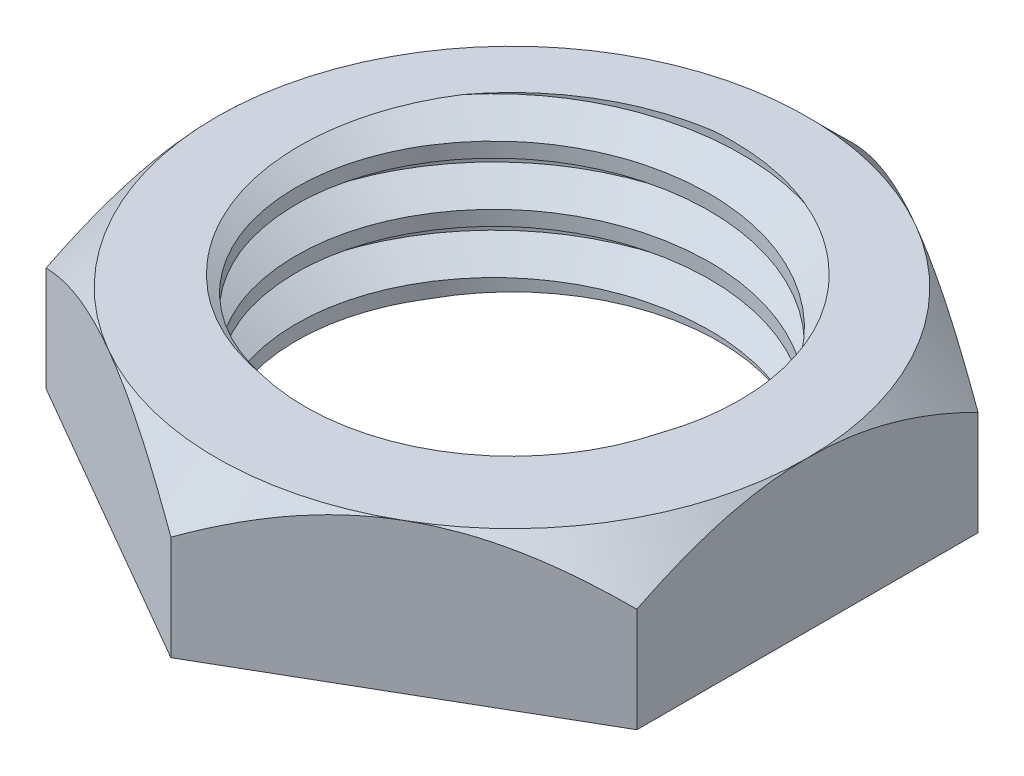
SolidWorks part; units mm, degrees
ref_plane "Front Plane" through (0, 0, 0) normal (0, 0, 1) x (1, 0, 0)
ref_plane "Top Plane" through (0, 0, 0) normal (0, 1, 0) x (1, 0, 0)
ref_plane "Right Plane" through (0, 0, 0) normal (1, 0, 0) x (0, 0, -1)
sketch "Sketch1" plane through (0, 0, 0) normal (0, 1, 0) x (1, 0, 0)
  line L1 (5, 2.8868) -> (0, 5.7735)
  line L2 (0, 5.7735) -> (-5, 2.8868)
  line L3 (-5, 2.8868) -> (-5, -2.8868)
  line L4 (-5, -2.8868) -> (0, -5.7735)
  line L5 (0, -5.7735) -> (5, -2.8868)
  line L6 (5, -2.8868) -> (5, 2.8868)
  circle A0 centre (0, 0) radius 5 construction
  circle A1 centre (0, 0) radius 3.5
  dimension "D1" = 10
  dimension "D2" = 7
extrude "Boss-Extrude1" add sketch "Sketch1" along normal mid plane 2.54
thread "Thread1" pitch 1 start angle 0, offset 2.54, length 10, pitch 1, diameter 7
ref_plane "Plane1" through (-3.5, 3.81, 0) normal (0, 0, 1) x (-1, 0, 0)
sketch "Thread Profile1" plane through (-3.5, 3.81, 0) normal (0, 0, 1) x (-1, 0, 0)
  line L0 (0, 0) -> (0, 1) construction
  line L1 (0, 0) -> (0.5413, 0.3125)
  line L2 (0.5413, 0.3125) -> (0.5413, 0.4375)
  line L3 (0.5413, 0.4375) -> (0, 0.75)
  line L4 (0.5413, 0.375) -> (0, 0.375) construction
  line L11 (0, 0) -> (0, 0.75)
  point P2 (0, 0)
  dimension "Pitch" = 1
  dimension "Profile_Angle" = 60
  dimension "Profile_Land" = 0.125
  dimension "Profile_Height" = 0.5413
sketch "Sketch5" plane through (0, 1.27, 0) normal (0, 1, 0) x (1, 0, 0)
  circle A0 centre (0, 0) radius 5
  dimension "D1" = 10
extrude "Cut-Extrude1" cut sketch "Sketch5" against normal mid plane 2.54 draft 45 flip side to cut
